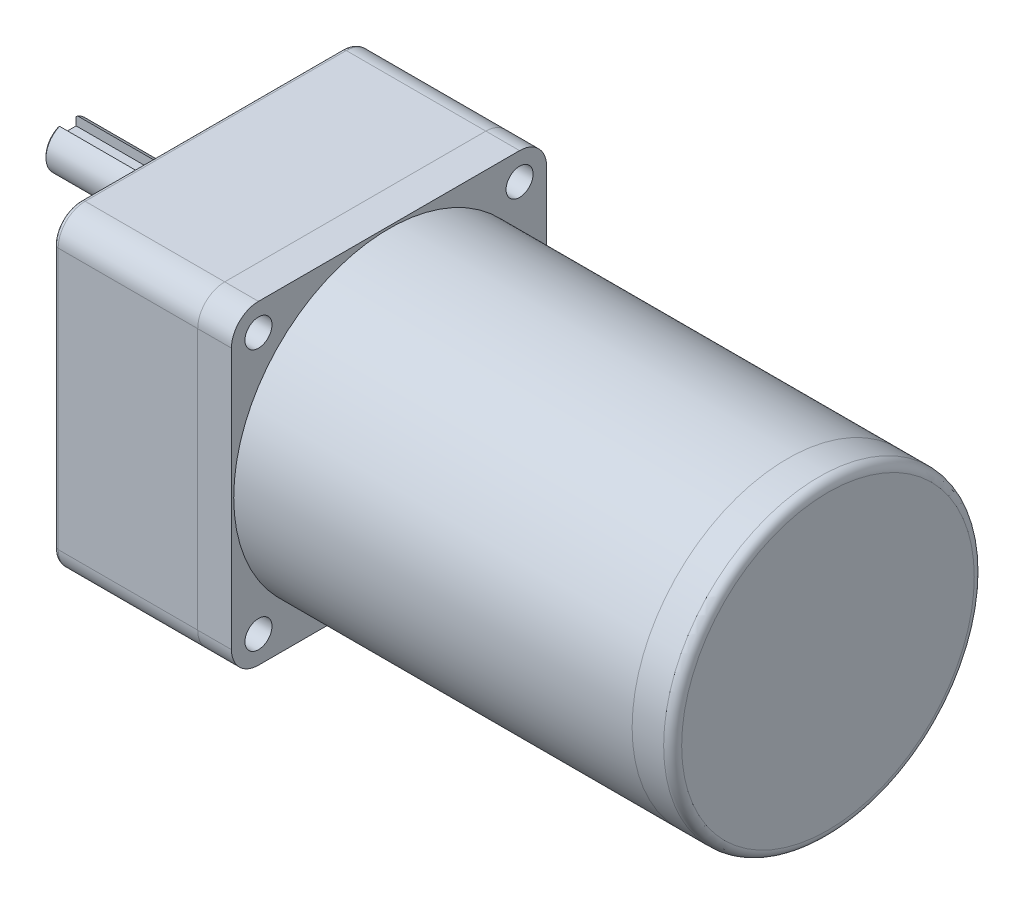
SolidWorks part; units mm, degrees
ref_plane "前视基准面" through (0, 0, 0) normal (0, 0, 1) x (1, 0, 0)
ref_plane "上视基准面" through (0, 0, 0) normal (0, 1, 0) x (1, 0, 0)
ref_plane "右视基准面" through (0, 0, 0) normal (1, 0, 0) x (0, 0, -1)
sketch "草图1" plane through (0, 0, 0) normal (1, 0, 0) x (0, 0, -1)
  line L1 (29, -35) -> (-29, -35)
  line L2 (35, -29) -> (35, 29)
  line L3 (29, 35) -> (-29, 35)
  line L4 (-35, -29) -> (-35, 29)
  line L5 (35, -35) -> (-35, 35) construction
  line L6 (35, 35) -> (-35, -35) construction
  arc A0 (-29, -35) -> (-35, -29) centre (-29, -29) cw
  arc A1 (29, -35) -> (35, -29) centre (29, -29) ccw
  arc A2 (35, 29) -> (29, 35) centre (29, 29) ccw
  arc A3 (-29, 35) -> (-35, 29) centre (-29, 29) ccw
  point P0 (0, 0)
  dimension "D1" = 6
extrude "凸台-拉伸1" add sketch "草图1" along normal blind 32
sketch "草图2" plane through (32, 0, 0) normal (1, 0, 0) x (0, 0, -1)
  line L0 (29, 35) -> (-29, 35) construction
  line L1 (-29, -35) -> (29, -35)
  line L2 (-35, -29) -> (-35, 29)
  line L3 (-29, 35) -> (29, 35)
  line L4 (35, -29) -> (35, 29)
  line L5 (-35, -35) -> (35, 35) construction
  line L6 (-35, 35) -> (35, -35) construction
  arc A0 (29, 35) -> (35, 29) centre (29, 29) cw
  arc A1 (29, -35) -> (35, -29) centre (29, -29) ccw
  arc A2 (-29, -35) -> (-35, -29) centre (-29, -29) cw
  arc A3 (-35, 29) -> (-29, 35) centre (-29, 29) cw
  point P0 (0, 0)
  dimension "D1" = 6
extrude "凸台-拉伸2" add sketch "草图2" along normal blind 7.5 separate body
fillet "圆角1" radius 1 8 edges at (0, -35, 0) (0, -33.2426, -33.2426) (0, 0, -35) (0, 33.2426, -33.2426) (0, 35, 0) (0, 33.2426, 33.2426) (0, 0, 35) (0, -33.2426, 33.2426)
sketch "草图5" plane through (0, 0, 0) normal (-1, 0, 0) x (0, 0, 1)
  point P19 (-28.9914, 28.9914)
  point P20 (28.9914, 28.9914)
  point P21 (28.9914, -28.9914)
  point P22 (-28.9914, -28.9914)
hole_wizard "M5 螺纹孔1" positions "3D草图1" profile "草图6" tap size "M5" standard "GB"
sketch3d "3D草图1"
  point P0 (0, 28.9914, -28.9914)
  point P3 (0, -28.9914, -28.9914)
  point P6 (0, -28.9914, 28.9914)
  point P9 (0, 28.9914, 28.9914)
sketch "草图6" plane through (0, 28.9914, -28.9914) normal (0, 1, 0) x (0, 0, 1)
  line L0 (0, 0) -> (0, 15.2618)
  line L1 (0, 15.2618) -> (2.1, 14)
  line L2 (2.1, 14) -> (2.1, 0)
  line L5 (2.1, 0) -> (0, 0)
  line L10 (0, 15.2618) -> (-2.1, 14) construction
  line L11 (0, -6.35) -> (0, 107.95) construction
  dimension "螺纹孔钻头直径" = 4.2
  dimension "螺纹孔钻头深度" = 14
  dimension "导头角度" = 118
sketch "草图7" plane through (39.5, 0, 0) normal (1, 0, 0) x (0, 0, -1)
  circle A1 centre (-29, 29) radius 3
  circle A2 centre (29, 29) radius 3
  circle A3 centre (29, -29) radius 3
  circle A4 centre (-29, -29) radius 3
extrude "切除-拉伸1" cut sketch "草图7" against normal blind 25.5
sketch "草图8" plane through (0, 0, 0) normal (-1, 0, 0) x (0, 0, 1)
  circle A0 centre (0, 15) radius 12
extrude "凸台-拉伸5" add sketch "草图8" along normal blind 3 separate body
sketch "草图9" plane through (-3, 0, 0) normal (-1, 0, 0) x (0, 0, 1)
  circle A0 centre (0, 15) radius 5
extrude "凸台-拉伸6" add sketch "草图9" along normal blind 29 separate body
fillet "圆角3" radius 0.5 1 edges at (-3, 15, 12)
sketch "草图10" plane through (0, 0, 0) normal (-1, 0, 0) x (0, 0, 1)
  circle A0 centre (0, 0) radius 30
extrude "切除-拉伸2" cut sketch "草图10" against normal blind 0.5
ref_plane "基准面1" through (0, 20, 0) normal (0, 1, 0) x (1, 0, 0)
sketch "草图11" plane through (0, 20, 0) normal (0, 1, 0) x (1, 0, 0)
  line L1 (-32, 5) -> (-32, -5) construction
  line L2 (-9, 2) -> (-32, 2)
  line L3 (-32, 2) -> (-32, -2)
  line L4 (-32, -2) -> (-9, -2)
  arc A0 (-9, -2) -> (-9, 2) centre (-9, 0) ccw
extrude "切除-拉伸3" cut sketch "草图11" against normal blind 2.5
chamfer "倒角1" distance 0.3 angle 45 1 edges at (-32, 10, 0)
sketch "草图12" plane through (39.5, 0, 0) normal (1, 0, 0) x (0, 0, -1)
  circle A0 centre (0, 0) radius 34.5
extrude "凸台-拉伸7" add sketch "草图12" along normal blind 88.5 separate body
sketch "草图13" plane through (128, 0, 0) normal (1, 0, 0) x (0, 0, -1)
  circle A0 centre (0, 0) radius 34.5
extrude "凸台-拉伸8" add sketch "草图13" along normal blind 9 separate body
fillet "圆角4" radius 2 1 edges at (137, 0, -34.5)
